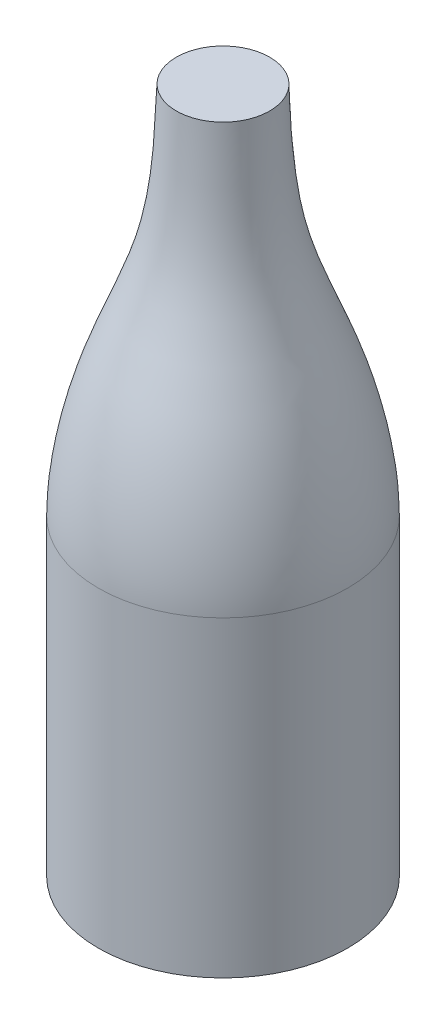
SolidWorks part; units mm, degrees
ref_plane "正面" through (0, 0, 0) normal (0, 0, 1) x (1, 0, 0)
ref_plane "平面" through (0, 0, 0) normal (0, 1, 0) x (1, 0, 0)
ref_plane "右側面" through (0, 0, 0) normal (1, 0, 0) x (0, 0, -1)
sketch "ｽｹｯﾁ1" plane through (0, 0, 0) normal (0, 0, 1) x (1, 0, 0)
  line L0 (0, 0) -> (0, 88.4214) construction
  line L1 (0, 0) -> (20, 0)
  line L2 (20, 0) -> (20, 50)
  line L3 (-17.896, 110) -> (30.2023, 110) construction
  line L4 (7.4839, 110) -> (0, 110)
  line L5 (0, 0) -> (0, 110)
  spline S0 degree 3 poles (20, 50) (20, 56.2766) (17.1722, 70.5612) (8.261, 88.9081) (7.7547, 102.6496) (7.4839, 110) knots 0 0 0 0 0.341056 0.647526 1 1 1 1
  dimension "D1" = 20
  dimension "D2" = 50
  dimension "D3" = 110
revolve "回転1" add sketch "ｽｹｯﾁ1" angle 360 about L0
